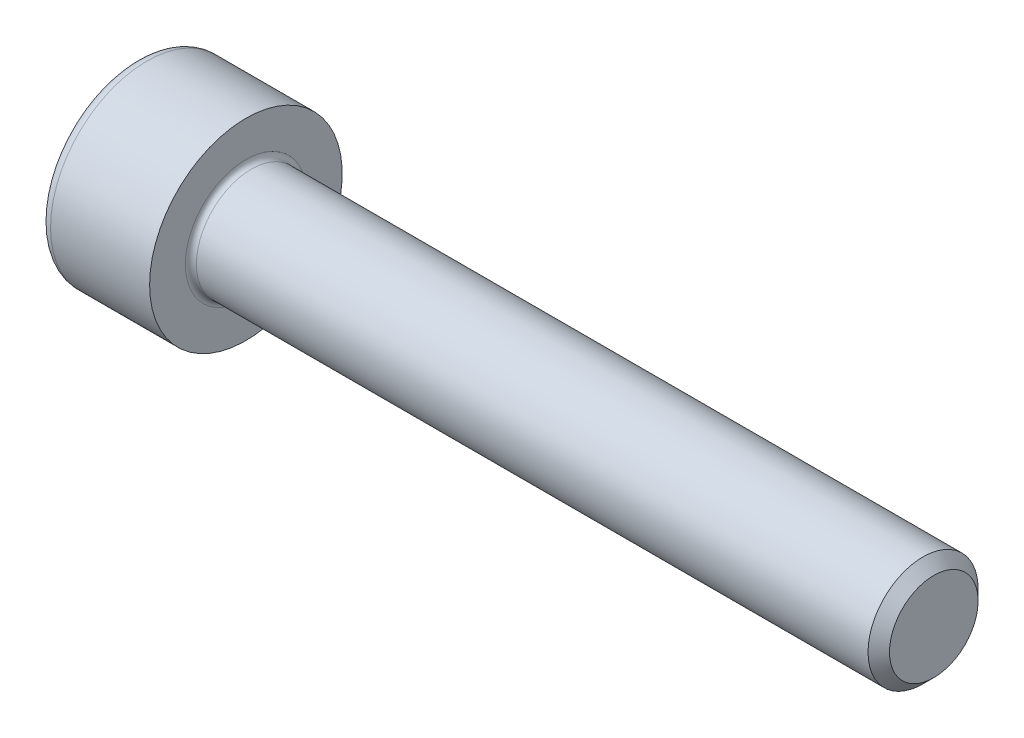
SolidWorks part; units mm, degrees
revolve "Base-Revolve" add sketch "BodySke"
sketch "BodySke" plane through (0, 0, 0) normal (0, 0, 1) x (1, 0, 0)
  line L0 (0, 0) -> (0, 3.5)
  line L1 (0, 3.5) -> (4, 3.5)
  line L2 (4, 3.5) -> (4, 2)
  line L3 (4, 2) -> (28.61, 2)
  line L4 (29, 1.61) -> (29, 0)
  line L5 (29, 0) -> (0, 0)
  line L6 (-31.75, 0) -> (127, 0) construction
  line L8 (29, 1.61) -> (28.61, 2)
  line L10 (29, -1.61) -> (28.61, -2) construction
  line L11 (4.7, 9.525) -> (4.7, 3.175) construction
  line L12 (4, 9.525) -> (4, 3.175) construction
  line L13 (-31, 9.525) -> (-31, 3.175) construction
fillet "Fillet1" radius 0.2 1 edges at (4, 0, 2)
fillet "Fillet2" radius 0.4 1 edges at (0, 0, 3.5)
ref_plane "Plane1" through (0, 0, 0) normal (0, 0, 1) x (1, 0, 0)
ref_plane "Plane2" through (0, 0, 0) normal (0, 1, 0) x (1, 0, 0)
ref_plane "Plane3" through (0, 0, 0) normal (1, 0, 0) x (0, 0, -1)
sketch "Sketch2" plane through (0, 0, 0) normal (0, 0, 1) x (1, 0, 0)
  line L0 (0, 1.51) -> (2, 1.51)
  line L1 (2, 1.51) -> (2.8718, 0)
  line L2 (-31.75, 0) -> (127, 0) construction
  line L3 (2.8718, 0) -> (0, 0)
  line L4 (0, 0) -> (0, 1.51)
  line L6 (0, 0) -> (47.625, 0) construction
revolve "Hex-PreBroach" cut sketch "Sketch2" angle 360 about L6
sketch "Sketch3" plane through (0, 0, 0) normal (-1, 0, 0) x (0, 0.5, 0.866)
  line L0 (0.8718, 1.51) -> (-0.8718, 1.51)
  line L1 (-0.8718, 1.51) -> (-1.7436, 0)
  line L2 (0.8718, 1.51) -> (1.7436, 0)
  line L3 (0.8718, -1.51) -> (1.7436, 0)
  line L4 (0.8718, -1.51) -> (-0.8718, -1.51)
  line L5 (-0.8718, -1.51) -> (-1.7436, 0)
extrude "Hex" cut sketch "Sketch3" against normal blind 2
sketch "ThdSchSke" plane through (0, 0, 0) normal (0, 0, 1) x (1, 0, 0)
  line L0 (6.1, -1.61) -> (5.8269, -2)
  line L1 (6.1, -1.61) -> (6.3731, -2)
  line L2 (6.3731, -2) -> (6.3731, -2.5)
  line L3 (-3.175, 0) -> (5.1513, 0) construction
  line L4 (0, 3.1) -> (0, -3.1) construction
  line L5 (6.3731, -2.5) -> (5.8269, -2.5)
  line L6 (5.8269, -2.5) -> (5.8269, -2)
revolve "ThreadSchematic" [suppressed] cut sketch "ThdSchSke" angle 360 about L3
pattern_linear "ThdSchPat" [suppressed]
equation "\"D2@Sketch3\" = \"Hex_size@Sketch3\" / 2"
equation "\"D1@Sketch3\" = \"Hex_size@Sketch3\" / 2"
equation "\"D1@Sketch2\" = \"Hex_size@Sketch3\" / 2"
equation "\"Thread_minor@ThreadCosmetic\"  =  \"Minor_dia@BodySke\""
equation "\"Depth@Sketch2\" =  \"Key_eng@Hex\""
equation "\"Thread_length@ThreadCosmetic\" = ((sgn( (\"Length@BodySke\" - \"Advance@BodySke\" * 3.0) - \"Thread_nom@BodySke\" )-1)*( (\"Length@BodySke\" - \"Advance@BodySke\" * 3.0) - \"Thread_nom@BodySke\" ))/-2+ \"Thread_no"
equation "\"Thread_minor@ThdSchSke\" = \"Minor_dia@BodySke\""
equation "\"Diameter@ThdSchSke\" = \"Diameter@BodySke\""
equation "\"Overcut@ThdSchSke\" = \"Diameter@BodySke\" * 1.25"
equation "\"Start@ThdSchSke\" = \"Head_ht@BodySke\" + \"Length@BodySke\" - \"Thread_length@ThreadCosmetic\"  '---Non-countersunk---"
equation "\"Num_threads@ThdSchPat\" = int( \"Thread_length@ThreadCosmetic\" / \"Advance@BodySke\" + 0.999 )  + 1"
equation "\"Advance@ThdSchPat\" = \"Thread_length@ThreadCosmetic\" /  (\"Num_threads@ThdSchPat\" - 1) 'relax it"
equation "\"Num_threads@ThdSchPat\" = \"Num_threads@ThdSchPat\" - sgn( \"Num_threads@ThdSchPat\" - 1) '---chamfered tips only---"
